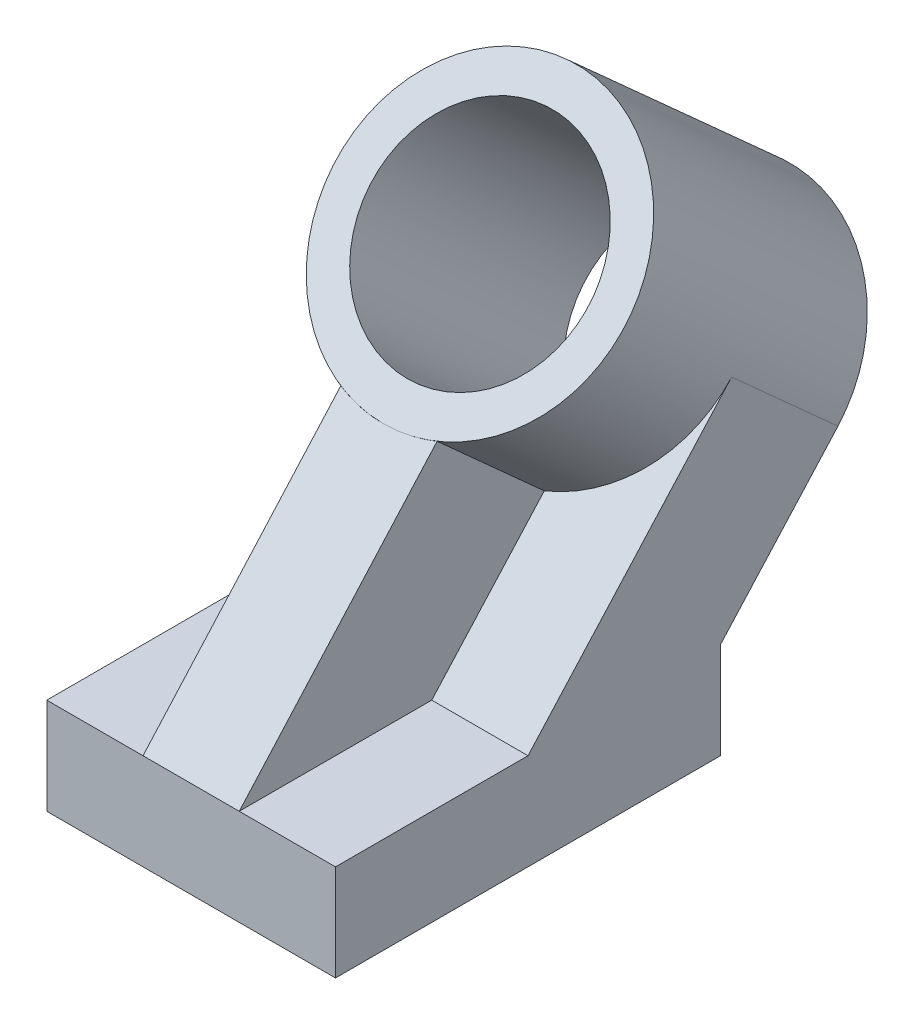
SolidWorks part; units mm, degrees
ref_plane "Front Plane" through (0, 0, 0) normal (0, 0, 1) x (1, 0, 0)
ref_plane "Top Plane" through (0, 0, 0) normal (0, 1, 0) x (1, 0, 0)
ref_plane "Right Plane" through (0, 0, 0) normal (1, 0, 0) x (0, 0, -1)
sketch "Sketch1" plane through (0, 0, 0) normal (1, 0, 0) x (0, 0, -1)
  line L0 (-50.8, 0) -> (50.8, 0)
  line L1 (-50.8, 0) -> (-50.8, 25.4)
  line L2 (50.8, 0) -> (50.8, 25.4)
  line L3 (-50.8, 25.4) -> (0, 25.4)
  line L4 (50.8, 25.4) -> (107.2856, 88.1336)
  line L5 (0, 25.4) -> (79.2305, 113.3944)
  line L6 (107.2856, 88.1336) -> (79.2305, 113.3944)
  dimension "D1" = 101.6
  dimension "D2" = 25.4
  dimension "D3" = 48
  dimension "D4" = 50.8
  dimension "D5" = 152.4
extrude "Boss-Extrude1" add sketch "Sketch1" along normal mid plane 76.2
ref_plane "Plane4" through (0, 11.3725, 12.6304) normal (0, 0.6691, 0.7431) x (1, 0, 0)
sketch "Sketch6" plane through (0, 11.3725, 12.6304) normal (0, 0.6691, 0.7431) x (1, 0, 0)
  line L1 (0, -33.9918) -> (0, 137.284) construction
  line L2 (38.1, -33.9918) -> (-38.1, -33.9918) construction
  line L4 (38.1, -15.116) -> (-38.1, -15.116) construction
  line L5 (38.1, 99.184) -> (38.1, 137.284)
  line L6 (-38.1, 99.184) -> (-38.1, 137.284)
  line L7 (38.1, 137.284) -> (-38.1, 137.284)
  arc A0 (38.1, 99.184) -> (-38.1, 99.184) centre (0, 99.184) ccw
  dimension "D2" = 76.2
  dimension "D1" = 114.3
  dimension "D3" = 76.2
  dimension "D4" = 152.4
extrude "Cut-Extrude5" cut sketch "Sketch6" against normal blind 38.1 contours A0 L7 L6 | A0 L5 L7
ref_plane "Plane5" through (0, 11.3725, 12.6304) normal (0, 0.6691, 0.7431) x (1, 0, 0)
sketch "Sketch7" plane through (0, 11.3725, 12.6304) normal (0, 0.6691, 0.7431) x (1, 0, 0)
  line L0 (0, -33.9918) -> (0, 137.284) construction
  line L1 (38.1, -33.9918) -> (-38.1, -33.9918) construction
  line L2 (38.1, -15.116) -> (-38.1, -15.116) construction
  arc A0 (38.1, 99.184) -> (-38.1, 99.184) centre (0, 99.184) ccw construction
  circle A1 centre (0, 99.184) radius 38.1
  dimension "D1" = 114.3
  dimension "D2" = 76.2
extrude "Boss-Extrude2" add sketch "Sketch7" along normal blind 38.1
ref_plane "Plane6" through (0, 36.8664, 40.9442) normal (0, 0.6691, 0.7431) x (1, 0, 0)
sketch "Sketch8" plane through (0, 36.8664, 40.9442) normal (0, 0.6691, 0.7431) x (1, 0, 0)
  line L0 (-38.1, 99.184) -> (38.1, 99.184) construction
  line L1 (0, 137.284) -> (0, 61.084) construction
  circle A0 centre (0, 99.184) radius 38.1 construction
  arc A1 (-38.1, 99.184) -> (38.1, 99.184) centre (0, 99.184) ccw construction
  circle A2 centre (0, 99.184) radius 28.575
  dimension "D1" = 57.15
extrude "Cut-Extrude6" cut sketch "Sketch8" against normal up to next
sketch "Sketch13" plane through (0, 0, 0) normal (1, 0, 0) x (0, 0, -1)
  line L0 (6.3024, 89.3391) -> (-50.8, 25.4)
rib "Rib8" sketch "Sketch13" sketch "Sketch13" thickness 25.4 extrusion direction parallel to sketch draft on no parameters "D1"=25.4
